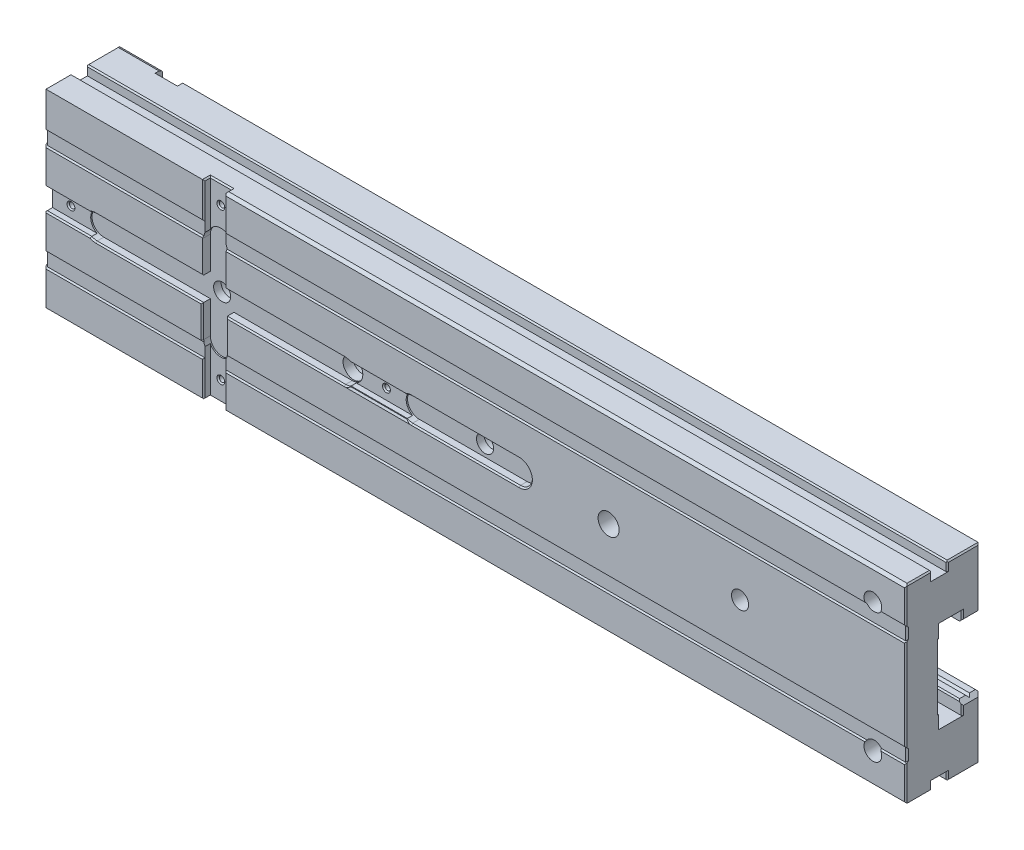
SolidWorks part; units mm, degrees
ref_plane "Front Plane" through (0, 0, 0) normal (0, 0, 1) x (1, 0, 0)
ref_plane "Top Plane" through (0, 0, 0) normal (0, 1, 0) x (1, 0, 0)
ref_plane "Right Plane" through (0, 0, 0) normal (1, 0, 0) x (0, 0, -1)
imported_body "Imported1"
sketch "Sketch1" plane through (0, 0, -24.2) normal (0, 0, -1) x (-1, 0, 0)
  circle A0 centre (248.5, 0) radius 10
  circle A1 centre (148.5, 0) radius 12.4968
  circle A2 centre (48.5, 0) radius 10
extrude "Boss-Extrude1" add sketch "Sketch1" against normal up to surface (18.2 mm away)
sketch "Sketch2" plane through (0, 0, -24.2) normal (0, 0, -1) x (-1, 0, 0)
  circle A0 centre (-51.5, 0) radius 12.4968
  circle A1 centre (-151.5, 0) radius 10
extrude "Boss-Extrude2" add sketch "Sketch2" against normal up to surface (24.2 mm away)
hole_wizard "Hole1" positions "Sketch4" profile "Sketch3" legacy
sketch "Sketch4" plane through (0, 0, -24.2) normal (0, 0, -1) x (-1, 0, 0)
  line L0 (377.5, 71.5) -> (377.5, 26.5) construction
  point P0 (248.5, 0)
  point P5 (48.5, 0)
  point P7 (-151.5, 0)
  dimension "D1" = 129
  dimension "D2" = 200
  dimension "D3" = 200
sketch "Sketch3" plane through (-248.5, 0, -24.2) normal (1, 0, 0) x (0, 1, 0)
  line L0 (0, 0) -> (0, 100)
  line L1 (0, 100) -> (6.5, 100)
  line L2 (6.5, 100) -> (6.5, 12.5)
  line L3 (6.5, 12.5) -> (9.5, 12.5)
  line L4 (9.5, 12.5) -> (9.5, 0)
  line L5 (9.5, 0) -> (0, 0)
  line L6 (0, 110) -> (0, -10) construction
  dimension "Diameter" = 13
  dimension "Depth" = 100
  dimension "C-Bore Diameter" = 19
  dimension "C-Bore Depth" = 12.5
hole_wizard "Hole2" positions "Sketch6" profile "Sketch5" legacy
sketch "Sketch6" plane through (0, 0, -24.2) normal (0, 0, -1) x (-1, 0, 0)
  circle A0 centre (248.5, 0) radius 9.5 construction
  point P0 (148.5, 0)
  point P2 (-51.5, 0)
  dimension "D1" = 100
  dimension "D2" = 200
sketch "Sketch5" plane through (-148.5, 0, -24.2) normal (1, 0, 0) x (0, 1, 0)
  line L0 (0, 0) -> (0, 100)
  line L1 (0, 100) -> (8, 100)
  line L2 (8, 100) -> (8, 11)
  line L3 (8, 11) -> (13, 11)
  line L4 (13, 11) -> (13, 0)
  line L5 (13, 0) -> (0, 0)
  line L6 (0, 110) -> (0, -10) construction
  dimension "Diameter" = 16
  dimension "Depth" = 100
  dimension "C-Bore Diameter" = 26
  dimension "C-Bore Depth" = 11
